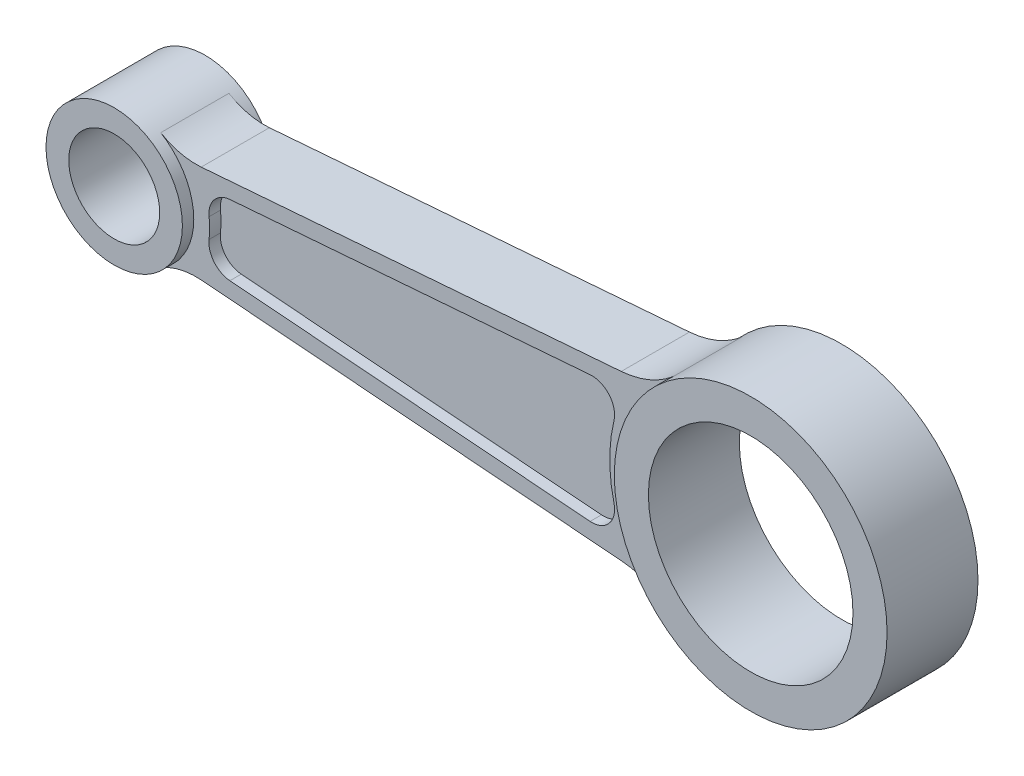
SolidWorks part; units mm, degrees
ref_plane "Front Plane" through (0, 0, 0) normal (0, 0, 1) x (1, 0, 0)
ref_plane "Top Plane" through (0, 0, 0) normal (0, 1, 0) x (1, 0, 0)
ref_plane "Right Plane" through (0, 0, 0) normal (1, 0, 0) x (0, 0, -1)
sketch "Sketch1" plane through (0, 0, 0) normal (0, 1, 0) x (1, 0, 0)
  line L0 (38.1, 25.4) -> (0, 25.4)
  line L1 (0, 25.4) -> (0, 19.05)
  line L2 (0, 19.05) -> (38.1, 19.05)
  line L3 (38.1, 19.05) -> (38.1, 25.4)
  line L4 (0, 25.4) -> (0, 19.05) construction
revolve "Revolve1" add sketch "Sketch1" angle 360 about L4
sketch "Sketch2" plane through (0, 0, -19.05) normal (0, 0, 1) x (1, 0, 0)
  line L0 (295.8347, -47.271) -> (42.2666, -27.3147)
  line L1 (42.2666, 27.3147) -> (295.8347, 47.271)
  arc A0 (295.8347, 47.271) -> (295.8347, -47.271) centre (355.6, 0) cw
  arc A1 (42.2666, -27.3147) -> (19.6386, -32.6486) centre (39.2773, -65.2973) ccw
  arc A2 (19.6386, -32.6486) -> (19.6386, 32.6486) centre (0, 0) cw
  arc A3 (19.6386, 32.6486) -> (42.2666, 27.3147) centre (39.2773, 65.2973) ccw
extrude "Boss-Extrude1" add sketch "Sketch2" along normal blind 44.45
sketch "Sketch3" plane through (0, 0, 25.4) normal (0, 0, 1) x (1, 0, 0)
  line L0 (42.2666, -27.3147) -> (295.8347, -47.271)
  line L1 (295.8347, 47.271) -> (42.2666, 27.3147)
  arc A0 (295.8347, -47.271) -> (295.8347, 47.271) centre (355.6, 0) cw
  arc A1 (42.2666, 27.3147) -> (19.6386, 32.6486) centre (39.2773, 65.2973) cw
  arc A2 (19.6386, 32.6486) -> (19.6386, -32.6486) centre (0, 0) cw
  arc A3 (19.6386, -32.6486) -> (42.2666, -27.3147) centre (39.2773, -65.2973) cw
extrude "Cut-Extrude1" cut sketch "Sketch3" against normal blind 6.35
sketch "Sketch4" plane through (0, 0, -19.05) normal (0, 0, -1) x (-1, 0, 0)
  circle A0 centre (-355.6, 0) radius 76.2
extrude "Boss-Extrude2" add sketch "Sketch4" along normal blind 6.35
sketch "Sketch5" plane through (0, 0, -19.05) normal (0, 0, -1) x (-1, 0, 0)
  line L0 (-43.2073, 18.4713) -> (-259.5169, 35.4952)
  line L1 (-259.5169, -35.4952) -> (-43.2073, -18.4713)
  arc A0 (-43.2073, -18.4713) -> (-43.2073, 18.4713) centre (0, 0) cw
  arc A1 (-259.5169, 35.4952) -> (-272.8622, 19.8689) centre (-260.5133, 22.8344) ccw
  arc A2 (-272.8622, 19.8689) -> (-272.8622, -19.8689) centre (-355.6, 0) cw
  arc A3 (-272.8622, -19.8689) -> (-259.5169, -35.4952) centre (-260.5133, -22.8344) ccw
extrude "Cut-Extrude2" cut sketch "Sketch5" against normal blind 6.35
sketch "Sketch6" plane through (0, 0, 19.05) normal (0, 0, 1) x (1, 0, 0)
  line L0 (259.5169, 35.4952) -> (43.2073, 18.4713)
  line L1 (43.2073, -18.4713) -> (259.5169, -35.4952)
  arc A0 (43.2073, 18.4713) -> (43.2073, -18.4713) centre (0, 0) cw
  arc A1 (259.5169, -35.4952) -> (272.8622, -19.8689) centre (260.5133, -22.8344) ccw
  arc A2 (272.8622, -19.8689) -> (272.8622, 19.8689) centre (355.6, 0) cw
  arc A3 (272.8622, 19.8689) -> (259.5169, 35.4952) centre (260.5133, 22.8344) ccw
extrude "Cut-Extrude3" cut sketch "Sketch6" against normal blind 6.35
hole_wizard "Hole1" positions "Sketch8" profile "Sketch7" legacy
sketch "Sketch8" plane through (0, 0, 25.4) normal (0, 0, 1) x (1, 0, 0)
  point P0 (355.6, 0)
sketch "Sketch7" plane through (355.6, 0, 25.4) normal (1, 0, 0) x (0, -1, 0)
  line L0 (0, 0) -> (0, 50.8)
  line L1 (0, 50.8) -> (57.15, 50.8)
  line L2 (57.15, 50.8) -> (57.15, 0)
  line L3 (57.15, 0) -> (0, 0)
  line L4 (0, 110) -> (0, -10) construction
  dimension "Diameter" = 114.3
  dimension "Depth" = 50.8
hole_wizard "Hole2" positions "Sketch10" profile "Sketch9" legacy
sketch "Sketch10" plane through (0, 0, 25.4) normal (0, 0, 1) x (1, 0, 0)
  point P0 (0, 0)
sketch "Sketch9" plane through (0, 0, 25.4) normal (1, 0, 0) x (0, -1, 0)
  line L0 (0, 0) -> (0, 50.8)
  line L1 (0, 50.8) -> (25.4, 50.8)
  line L2 (25.4, 50.8) -> (25.4, 0)
  line L3 (25.4, 0) -> (0, 0)
  line L4 (0, 110) -> (0, -10) construction
  dimension "Diameter" = 50.8
  dimension "Depth" = 50.8
fillet "Fillet1" radius 12.7 4 edges at (43.2073, 18.4713, 15.875) (43.2073, -18.4713, 15.875) (43.2073, 18.4713, -15.875) (43.2073, -18.4713, -15.875)
fillet "Fillet2" radius 50.8 2 edges at (295.8347, -47.271, 0) (295.8347, 47.271, 0)
